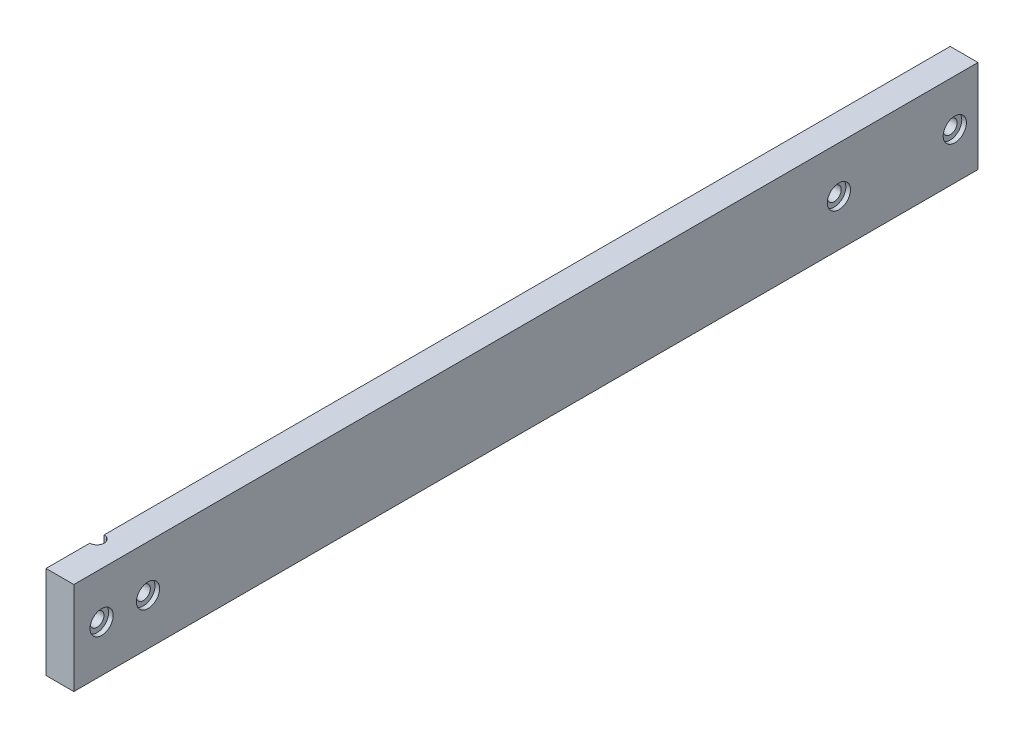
SolidWorks part; units mm, degrees
ref_plane "Plan de face" through (0, 0, 0) normal (0, 0, 1) x (1, 0, 0)
ref_plane "Plan de dessus" through (0, 0, 0) normal (0, 1, 0) x (1, 0, 0)
ref_plane "Plan de droite" through (0, 0, 0) normal (1, 0, 0) x (0, 0, -1)
sketch "Esquisse1" plane through (0, 0, 0) normal (1, 0, 0) x (0, 0, -1)
  line L0 (-8.7785, 10) -> (204.4142, 10) construction
  line L1 (0, 0) -> (195, 0)
  line L2 (0, 0) -> (0, 20)
  line L3 (0, 20) -> (195, 20)
  line L4 (195, 0) -> (195, 20)
  line L5 (6, -5.9745) -> (6, 29.8289) construction
  line L6 (16, 29.8289) -> (16, -5.9745) construction
  line L7 (195, -9.5329) -> (195, 32.9555) construction
  line L8 (190, 32.9555) -> (190, -9.5329) construction
  line L9 (165, -9.5329) -> (165, 32.9555) construction
  circle A0 centre (6, 10) radius 1.5
  circle A1 centre (16, 10) radius 1.5
  circle A2 centre (165, 10) radius 1.5
  circle A3 centre (190, 10) radius 1.5
  dimension "D1" = 5
  dimension "D2" = 25
extrude "Extrusion1" add sketch "Esquisse1" along normal blind 6
sketch "Esquisse2" plane through (6, 0, 0) normal (1, 0, 0) x (0, 0, -1)
  line L0 (-8.6334, 10) -> (203.4496, 10) construction
  line L1 (6, -5.1619) -> (6, 26.4484) construction
  line L2 (16, -5.1619) -> (16, 26.4484) construction
  line L3 (165, -5.1619) -> (165, 26.4484) construction
  line L4 (190, 26.4484) -> (190, -5.1619) construction
  circle A0 centre (6, 10) radius 2.5
  circle A1 centre (16, 10) radius 2.5
  circle A2 centre (165, 10) radius 2.5
  circle A3 centre (190, 10) radius 2.5
extrude "Enlèv. mat.-Extru.1" cut sketch "Esquisse2" against normal blind 1
sketch "Esquisse3" plane through (0, 0, 0) normal (0, -1, 0) x (1, 0, 0)
  line L0 (-12.131, 0) -> (16.8277, 0) construction
  line L1 (0, -9.45) -> (0, -12.55)
  line L2 (11, -11) -> (-12.131, -11) construction
  line L4 (0, 13.1368) -> (0, -201.9603) construction
  arc A0 (0, -12.55) -> (0, -9.45) centre (0, -11) ccw
extrude "Enlèv. mat.-Extru.2" cut sketch "Esquisse3" against normal through all
